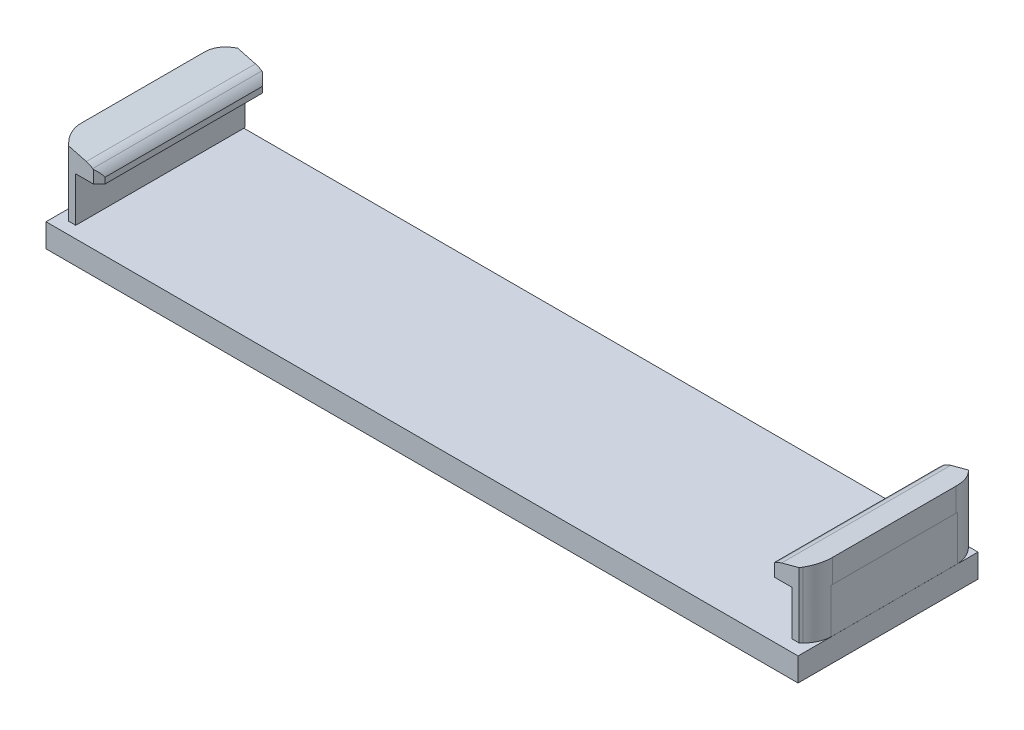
SolidWorks part; units mm, degrees
ref_plane "前视基准面" through (0, 0, 0) normal (0, 0, 1) x (1, 0, 0)
ref_plane "上视基准面" through (0, 0, 0) normal (0, 1, 0) x (1, 0, 0)
ref_plane "右视基准面" through (0, 0, 0) normal (1, 0, 0) x (0, 0, -1)
other "Configuration Table"
imported_body "曲面-输入1"
sketch "草图1" plane through (0, 0, 0) normal (0, 1, 0) x (1, 0, 0)
  line L1 (32, -14.4) -> (-32.0308, -14.4)
  line L2 (32, -14.4) -> (32, 0)
  line L3 (32, 0) -> (-32.0308, 0)
  line L4 (-32.0308, -14.4) -> (-32.0308, 0)
extrude "凸台-拉伸1" add sketch "草图1" along normal blind 3
sketch "草图2" plane through (0, 3, 0) normal (0, 1, 0) x (1, 0, 0)
  line L1 (-30.5, -14.4) -> (-31.9968, -14.4)
  line L2 (-30.5, -14.4) -> (-30.5, 0)
  line L3 (-30.5, 0) -> (-31.9968, 0)
  line L4 (-31.9968, -14.4) -> (-31.9968, 0)
extrude "凸台-拉伸2" add sketch "草图2" along normal blind 3.8
sketch "草图4" plane through (0, 0, 0) normal (0, 0, -1) x (-1, 0, 0)
  line L0 (32, 6.8) -> (28.5, 6.8)
  line L1 (28.5, 6.8) -> (28.5, 7.3)
  line L2 (29.6, 8.1569) -> (32, 8.8)
  line L4 (32, 8.8) -> (32, 6.8)
  line L5 (32, 0) -> (32, 8.8) construction
  arc A0 (28.5, 7.3) -> (29.0545, 7.9066) centre (30.0634, 6.4276) cw
  arc A1 (29.0545, 7.9066) -> (29.6, 8.1569) centre (30.0633, 6.4277) cw
extrude "凸台-拉伸3" add sketch "草图4" against normal up to surface (14.4 mm away)
sketch "草图7" plane through (0, 3, 0) normal (0, 1, 0) x (1, 0, 0)
  line L0 (-31.2678, -0.1678) -> (-31.1, 0)
  line L1 (-31.1, 0) -> (-32, 0)
  line L7 (-29, 0) -> (-28.3748, -0.6252)
  line L8 (-29, 0) -> (-28.3748, 0)
  line L10 (-28.3748, -0.6252) -> (-28.3748, 0)
  line L11 (-29, -14.4) -> (-28.3693, -14.4)
  line L12 (-28.3693, -14.4) -> (-28.3693, -13.7693)
  line L13 (-28.3693, -13.7693) -> (-29, -14.4)
  line L14 (-31.2678, -14.2322) -> (-31.1, -14.4)
  line L15 (-31.1, -14.4) -> (-32, -14.4)
  line L17 (-32, -12.4645) -> (-32.204, -13.8633)
  line L18 (-32.204, -13.8633) -> (-32, -14.4)
  line L19 (-32, -1.9355) -> (-32.4306, -0.9761)
  line L20 (-32.4306, -0.9761) -> (-32, 0)
  arc A0 (-32, -1.9355) -> (-31.2678, -0.1678) centre (-29.5, -1.9355) cw
  arc A1 (-32, -12.4645) -> (-31.2678, -14.2322) centre (-29.5, -12.4645) ccw
extrude "切除-拉伸3" cut sketch "草图7" along normal through all
mirror "镜向1" about plane through (0, 0, 0) normal (1, 0, 0) of "切除-拉伸3", "凸台-拉伸3", "凸台-拉伸2"
sketch "草图8" plane through (0, 0, 0) normal (0, -1, 0) x (-1, 0, 0)
  line L0 (32.0308, 0) -> (32.0308, -14.4) construction
  line L1 (32.0308, -15.4) -> (-32, -15.4)
  line L2 (32.0308, -15.4) -> (32.0308, 24.8)
  line L3 (32.0308, 24.8) -> (-32, 24.8) construction
  line L4 (-32, -15.4) -> (-32, 24.8)
  line L5 (-32, -14.4) -> (-32, 0) construction
  line L6 (32.0308, -14.4) -> (-32, -14.4) construction
  line L7 (-32, -14.4) -> (-32, 0) construction
  line L8 (32.0308, 24.8) -> (17.3651, 24.8)
  line L12 (-17.3651, 24.8) -> (-32, 24.8)
  line L13 (17.3651, 24.8) -> (0, 0)
  line L14 (0, 0) -> (-17.3651, 24.8)
  point P12 (-32, -7.2)
  dimension "D1" = 1
  dimension "D2" = 32
  dimension "D3" = 125
  dimension "D4" = 125
extrude "凸台-拉伸4" add sketch "草图8" against normal up to surface (3 mm away)
other "移动面1" parameters "D1"=1
sketch "草图15" plane through (0, 3, 0) normal (0, 1, 0) x (1, 0, 0)
  line L1 (-36.6439, 25.1372) -> (37.5223, 25.1372)
  line L2 (-36.6439, 25.1372) -> (-36.6439, -0.0803)
  line L3 (-36.6439, -0.0803) -> (37.5223, -0.0803)
  line L4 (37.5223, 25.1372) -> (37.5223, -0.0803)
extrude "切除-拉伸6" cut sketch "草图15" against normal blind 20
